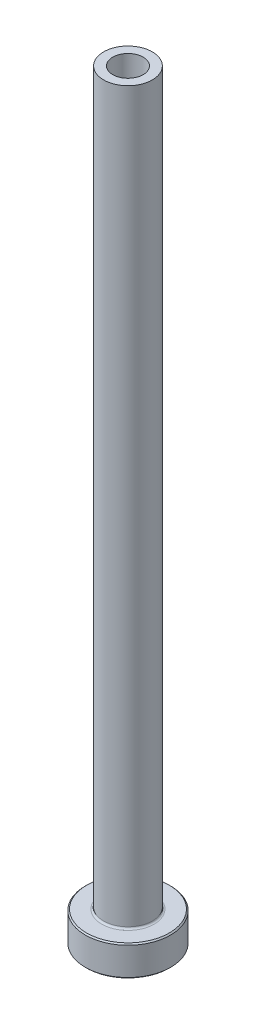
SolidWorks part; units mm, degrees
ref_plane "Front Plane" through (0, 0, 0) normal (0, 0, 1) x (1, 0, 0)
ref_plane "Top Plane" through (0, 0, 0) normal (0, 1, 0) x (1, 0, 0)
ref_plane "Right Plane" through (0, 0, 0) normal (1, 0, 0) x (0, 0, -1)
sketch "Sketch1" plane through (0, 0, 0) normal (0, 0, 1) x (1, 0, 0)
  line L0 (-2.5, 125) -> (-4, 125)
  line L1 (-4, 125) -> (-4, 5)
  line L2 (-4, 5) -> (-7, 5)
  line L3 (-7, 5) -> (-7, 0)
  line L4 (7.7, 0) -> (-7.7, 0) construction
  line L5 (-7, 0) -> (-2.75, 0)
  line L6 (-2.5, 80) -> (-2.5, 125)
  line L7 (0, 92.1877) -> (0, -15.5353) construction
  line L8 (0, -7.7) -> (0, 7.7) construction
  line L9 (-2.5, 80) -> (-2.75, 68)
  line L10 (-2.75, 68) -> (-2.75, 0)
  dimension "D1" = 0.25
  dimension "ID" = 5
  dimension "OD" = 8
  dimension "L" = 125
  dimension "H" = 14
  dimension "T" = 5
  dimension "N" = 45
  dimension "D2" = 12
revolve "Revolve1" add sketch "Sketch1" angle 360 about L7
fillet "Fillet1" radius 0.3 1 edges at (0, 5, 4)
chamfer "Chamfer1" distance 0.2 angle 45 2 edges at (0, 5, 7) (0, 0, 7)
chamfer "Chamfer3" distance 0.5 angle 45 1 edges at (0, 0, 2.75)
